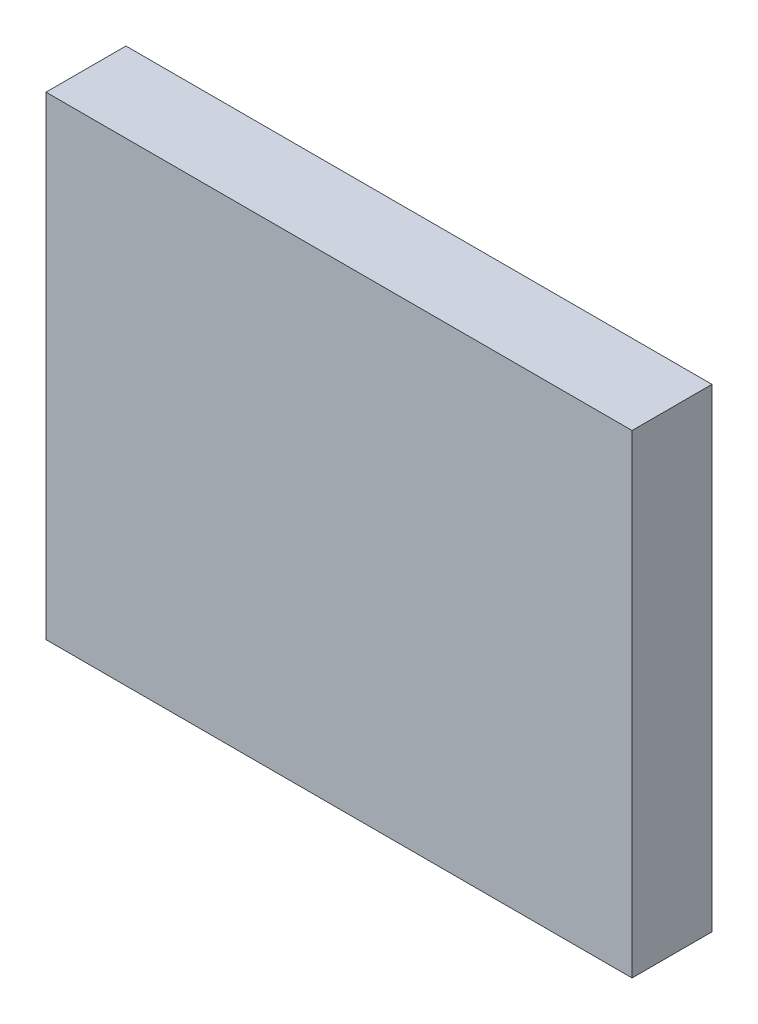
SolidWorks part; units mm, degrees
ref_plane "Piano frontale" through (0, 0, 0) normal (0, 0, 1) x (1, 0, 0)
ref_plane "Piano superiore" through (0, 0, 0) normal (0, 1, 0) x (1, 0, 0)
ref_plane "Piano destro" through (0, 0, 0) normal (1, 0, 0) x (0, 0, -1)
sketch "Schizzo1" plane through (0, 0, 0) normal (0, 0, 1) x (1, 0, 0)
  line L1 (0, 0) -> (-110, 0)
  line L2 (0, 0) -> (0, 89)
  line L3 (0, 89) -> (-110, 89)
  line L4 (-110, 0) -> (-110, 89)
extrude "Estrusione-Estrusione2" add sketch "Schizzo1" along normal blind 15
sketch "Schizzo2" plane through (0, 0, 15) normal (0, 0, 1) x (1, 0, 0)
  line L0 (-110, 89) -> (-95, 89)
  line L1 (0, 89) -> (-110, 89) construction
  line L2 (-95, 89) -> (-95, 76.2857)
  line L3 (-95, 76.2857) -> (-110, 76.2857)
  line L4 (-110, 89) -> (-110, 0) construction
  line L5 (-110, 63.5714) -> (-95, 63.5714)
  line L6 (-95, 63.5714) -> (-95, 50.8571)
  line L7 (-95, 50.8571) -> (-110, 50.8571)
  line L8 (-110, 38.1429) -> (-94.8828, 38.1429)
  line L9 (-94.8828, 38.1429) -> (-94.8828, 25.4329)
  line L10 (-94.8828, 25.4329) -> (-110, 25.4329)
  line L11 (-94.8828, 0) -> (-94.8828, 12.71)
  line L12 (-110, 0) -> (0, 0) construction
  line L13 (-94.8828, 12.71) -> (-110, 12.71)
equation "\"box_height\"= 89"
equation "\"box_lenght\"= 220"
equation "\"box_depth\"= 335"
equation "\"material_thickness\"= 15"
equation "\"dovetail_slope\"= 8"
equation "\"D1@Schizzo1\"=\"box_height\""
equation "\"D2@Schizzo1\"=\"box_lenght\"/2"
equation "\"D1@Estrusione-Estrusione2\"=\"material_thickness\""
equation "\"D1@Schizzo2\"=\"material_thickness\""
equation "\"D2@Schizzo2\"=\"box_height\"/7"
equation "\"D3@Schizzo2\"=\"D2@Schizzo2\""
